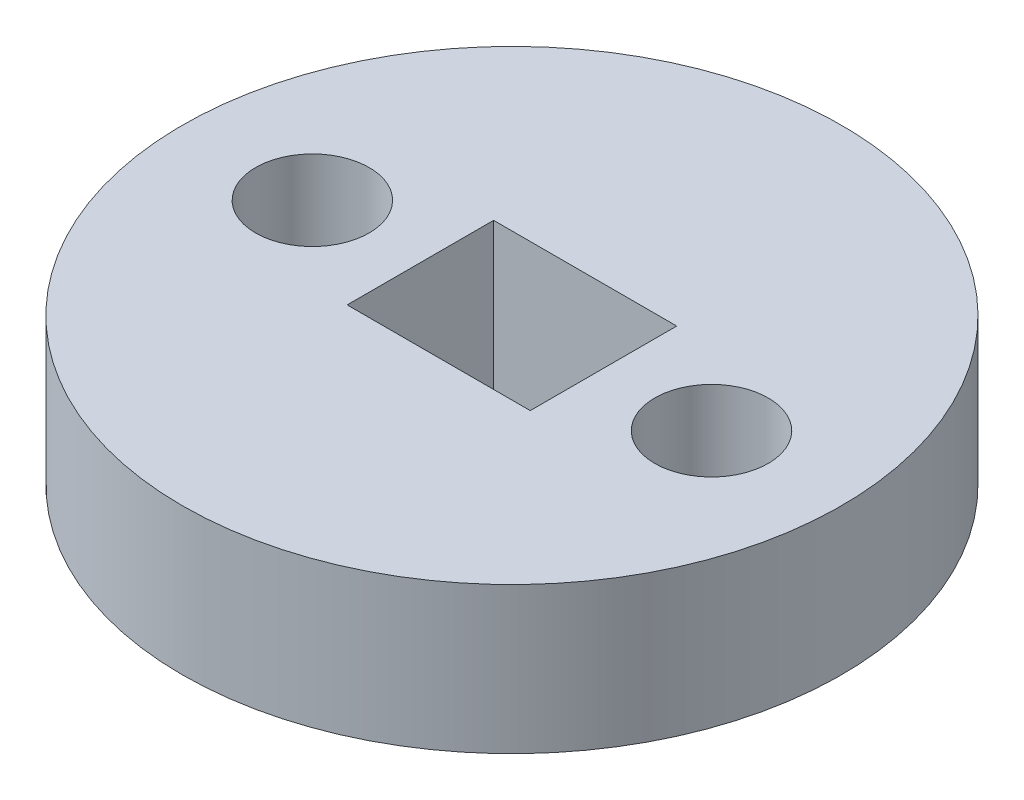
SolidWorks part; units mm, degrees
ref_plane "Front Plane" through (0, 0, 0) normal (0, 0, 1) x (1, 0, 0)
ref_plane "Top Plane" through (0, 0, 0) normal (0, 1, 0) x (1, 0, 0)
ref_plane "Right Plane" through (0, 0, 0) normal (1, 0, 0) x (0, 0, -1)
sketch "Sketch1" plane through (0, 0, 0) normal (0, 1, 0) x (1, 0, 0)
  circle A0 centre (0, 0) radius 9
  dimension "D1" = 18
base flange "Base-Flange1" sketch "Sketch1" thickness 4 reverse thickness direction no parameters "D1"=2
sketch "Sketch6" plane through (0, 0, 0) normal (0, 1, 0) x (1, 0, 0)
  line L1 (-2, 1.5) -> (2, 1.5)
  line L3 (0, -1.5) -> (2, -1.5)
  line L4 (0, -1.5) -> (-2, -1.5)
  arc A0 (-2, 1.5) -> (-2, -1.5) centre (0, 0) ccw
  arc A1 (2, -1.5) -> (2, 1.5) centre (0, 0) ccw
  point P7 (0, 1.5)
  dimension "D1" = 5
  dimension "D2" = 4
  dimension "D3" = 4
  dimension "D4" = 3
extrude "Cut-Extrude1" [suppressed] cut sketch "Sketch6" against normal blind 10
sketch "Sketch7" plane through (0, 0, 0) normal (0, 1, 0) x (1, 0, 0)
  line L0 (-5.45, 0) -> (5.45, 0) construction
  line L1 (-7, 0) -> (-9, 0) construction
  line L2 (7, 0) -> (9, 0) construction
  circle A0 centre (-5.45, 0) radius 1.55
  circle A1 centre (5.45, 0) radius 1.55
  circle A3 centre (0, 0) radius 9 construction
  point P4 (0, 0)
  dimension "D1" = 3.1
  dimension "D2" = 2
extrude "Cut-Extrude2" cut sketch "Sketch7" against normal blind 10
sketch "Sketch8" plane through (0, 0, 0) normal (0, 1, 0) x (1, 0, 0)
  line L0 (0, 2) -> (0, -2) construction
  line L1 (-2.5, -2) -> (2.5, -2)
  line L2 (-2.5, -2) -> (-2.5, 2)
  line L3 (-2.5, 2) -> (2.5, 2)
  line L4 (2.5, -2) -> (2.5, 2)
  point P4 (0, 0)
  dimension "D1" = 5
  dimension "D2" = 4
extrude "Cut-Extrude3" cut sketch "Sketch8" against normal blind 10
sketch "Bend-Lines1" plane through (0, 0, 0) normal (0, 1, 0) x (1, 0, 0)
sketch "Bounding-Box1" plane through (0, 0, 0) normal (0, 1, 0) x (1, 0, 0)
sheet metal parameters "Sheet-Metal1" thickness 4 parameters "D1"=2
flat pattern "Flat-Pattern1"
sketch "Bend-Lines2" plane through (0, 0, 0) normal (0, 1, 0) x (1, 0, 0)
sketch "Bounding-Box2" [suppressed] plane through (0, 0, 0) normal (0, 1, 0) x (1, 0, 0)
sheet metal parameters "Sheet-Metal2" thickness 4 parameters "D1"=2
flat pattern "Flat-Pattern1"
sketch "Bend-Lines2" plane through (0, 0, 0) normal (0, 1, 0) x (1, 0, 0)
sketch "Bounding-Box2" [suppressed] plane through (0, 0, 0) normal (0, 1, 0) x (1, 0, 0)
sheet metal parameters "Sheet-Metal3" thickness 4 parameters "D1"=2
flat pattern "Flat-Pattern1"
sketch "Bend-Lines2" plane through (0, 0, 0) normal (0, 1, 0) x (1, 0, 0)
sketch "Bounding-Box2" [suppressed] plane through (0, 0, 0) normal (0, 1, 0) x (1, 0, 0)
sheet metal parameters "Sheet-Metal4" thickness 4 parameters "D1"=2
flat pattern "Flat-Pattern1"
sketch "Bend-Lines2" plane through (0, 0, 0) normal (0, 1, 0) x (1, 0, 0)
sketch "Bounding-Box2" [suppressed] plane through (0, 0, 0) normal (0, 1, 0) x (1, 0, 0)
